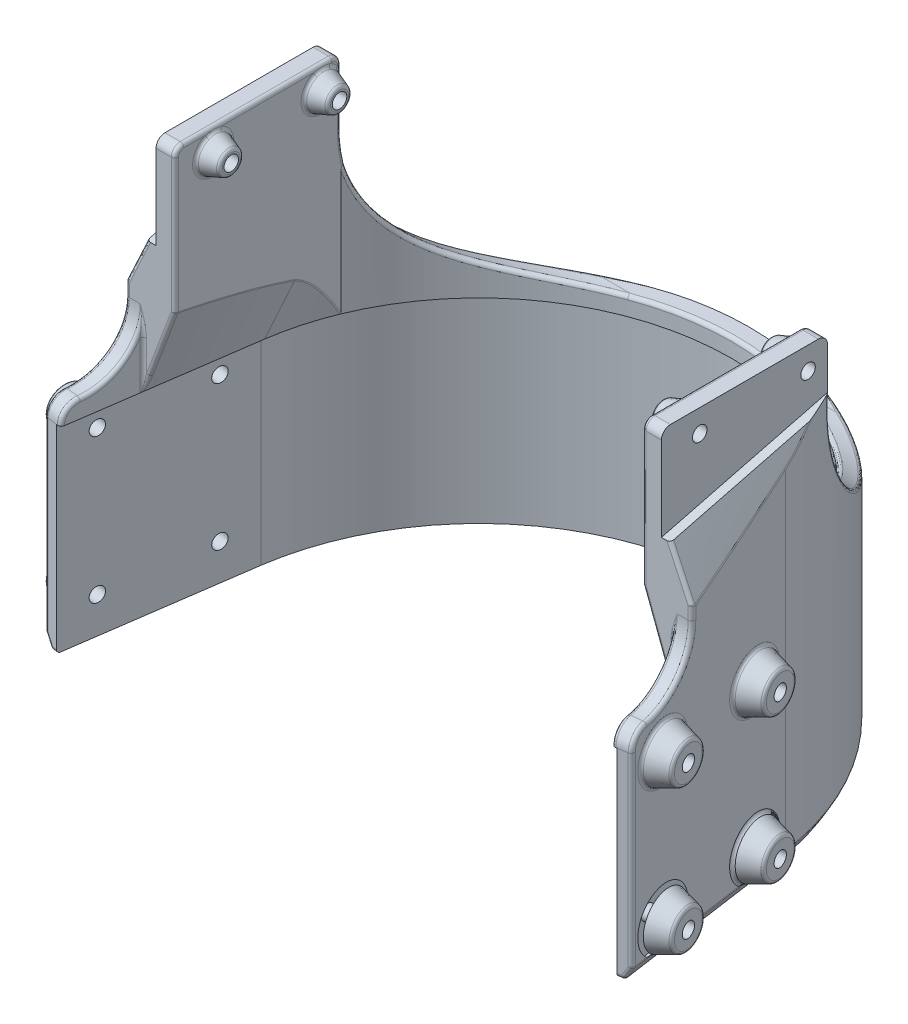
SolidWorks part; units mm, degrees
ref_plane "Front Plane" through (0, 0, 0) normal (0, 0, 1) x (1, 0, 0)
ref_plane "Top Plane" through (0, 0, 0) normal (0, 1, 0) x (1, 0, 0)
ref_plane "Right Plane" through (0, 0, 0) normal (1, 0, 0) x (0, 0, -1)
sketch "Sketch1" plane through (0, 0, 0) normal (0, 1, 0) x (1, 0, 0)
  line L0 (-94.2861, -143.8372) -> (-103.2971, -206.6946)
  line L1 (-103.2971, -206.6946) -> (-98.5828, -207.3704)
  line L2 (-98.5828, -207.3704) -> (-89.5718, -144.513)
  line L3 (0, -157.3537) -> (0, 60.4833) construction
  line L4 (103.2971, -206.6946) -> (98.5828, -207.3704)
  line L5 (98.5828, -207.3704) -> (89.5718, -144.513)
  line L6 (94.2861, -143.8372) -> (103.2971, -206.6946)
  line L8 (0, -157.3537) -> (-94.2861, -143.8372) construction
  line L9 (-89.5718, -144.513) -> (-107.0231, -266.2464) construction
  arc A0 (94.2861, -143.8372) -> (-94.2861, -143.8372) centre (0, -157.3537) ccw
  arc A1 (-89.5718, -144.513) -> (89.5718, -144.513) centre (0, -157.3537) cw
  arc A2 (89.5718, -144.513) -> (-89.5718, -144.513) centre (0, -157.3537) ccw construction
  dimension "D2" = 4.7625
  dimension "D3" = 63.5
extrude "Boss-Extrude1" add sketch "Sketch1" along normal blind 76.2
sketch "Sketch17" plane through (0, 76.2, 0) normal (0, 1, 0) x (1, 0, 0)
  line L10 (-97.0114, -207.5957) -> (-88.0003, -144.7383)
  line L11 (88.0003, -144.7383) -> (97.0114, -207.5957)
  line L12 (-98.5828, -207.3704) -> (-89.5718, -144.513)
  line L13 (89.5718, -144.513) -> (98.5828, -207.3704)
  line L14 (-98.5828, -207.3704) -> (-89.5718, -144.513)
  line L15 (89.5718, -144.513) -> (98.5828, -207.3704)
  line L16 (98.5828, -207.3704) -> (97.0114, -207.5957)
  line L17 (-97.0114, -207.5957) -> (-98.5828, -207.3704)
  arc A4 (88.0003, -144.7383) -> (-88.0003, -144.7383) centre (0, -157.3537) ccw
  arc A5 (89.5718, -144.513) -> (-89.5718, -144.513) centre (0, -157.3537) ccw
  arc A6 (89.5718, -144.513) -> (-89.5718, -144.513) centre (0, -157.3537) ccw
  dimension "D1" = 0
  dimension "D2" = 1.5875
extrude "Boss-Extrude5" add sketch "Sketch17" against normal blind 6.35
sketch "Sketch10" plane through (0, 69.85, 0) normal (0, 1, 0) x (1, 0, 0)
  line L0 (-99.7636, -182.0462) -> (-82.2536, -182.0462)
  line L1 (-94.2861, -143.8372) -> (-103.2971, -206.6946) construction
  line L2 (-88.9, -185.8562) -> (-85.725, -185.8562) construction
  line L3 (-99.7636, -182.0462) -> (-94.2861, -143.8372)
  line L5 (-88.9, -192.0474) -> (-88.9, -103.6441) construction
  line L20 (-82.2536, -182.0462) -> (-82.2536, -123.6262)
  line L21 (-82.2536, -123.6262) -> (-89.0787, -123.6262)
  arc A0 (-94.2861, -143.8372) -> (-89.0787, -123.6262) centre (0, -157.3537) cw
  arc A1 (94.2861, -143.8372) -> (-94.2861, -143.8372) centre (0, -157.3537) ccw construction
  arc A2 (88.0003, -144.7383) -> (-88.0003, -144.7383) centre (0, -157.3537) ccw construction
  dimension "D1" = 3.81
  dimension "D2" = 58.42
  dimension "D3" = 6.6464
extrude "Boss-Extrude3" add sketch "Sketch10" along normal up to surface (79.502 mm away)
sketch "Sketch22" plane through (0, 149.352, 0) normal (0, 1, 0) x (1, 0, 0)
  line L4 (-88.9, -123.1579) -> (-88.9, -182.0462)
  line L6 (-88.9, -192.0474) -> (-88.9, -103.6441) construction
  line L8 (-94.2861, -143.8372) -> (-99.7636, -182.0462)
  line L9 (-99.7636, -182.0462) -> (-82.2536, -182.0462)
  line L10 (-82.2536, -182.0462) -> (-82.2536, -123.6262)
  line L11 (-82.2536, -123.6262) -> (-89.0787, -123.6262)
  line L12 (-94.2861, -143.8372) -> (-99.7636, -182.0462)
  line L13 (-99.7636, -182.0462) -> (-88.9, -182.0462)
  arc A2 (-89.0787, -123.6262) -> (-94.2861, -143.8372) centre (0, -157.3537) ccw
  arc A3 (-88.9, -123.1579) -> (-94.2861, -143.8372) centre (0, -157.3537) ccw
  dimension "D1" = 0
extrude "Cut-Extrude4" cut sketch "Sketch22" against normal up to surface (32.818 mm away)
sketch "Sketch29" plane through (0, 0, 182.0462) normal (0, 0, 1) x (1, 0, 0)
  line L0 (-92.075, 116.534) -> (-99.7636, 100.024)
  line L1 (-99.7636, 116.534) -> (-99.7636, 76.2) construction
  line L2 (-99.7636, 100.024) -> (-99.7636, 116.534)
  line L3 (-99.7636, 116.534) -> (-92.075, 116.534)
  line L4 (-88.9, 116.534) -> (-99.7636, 116.534) construction
  dimension "D1" = 3.175
  dimension "D2" = 16.51
sketch "Sketch30" plane through (0, 0, 123.6262) normal (0, 0, -1) x (-1, 0, 0)
  line L0 (92.075, 131.4708) -> (98.425, 131.4708)
  line L1 (98.425, 131.4708) -> (98.425, 114.9608)
  line L2 (98.425, 114.9608) -> (92.075, 131.4708)
  line L3 (88.9, 131.4708) -> (88.9, 149.352) construction
  dimension "D1" = 3.175
  dimension "D2" = 16.51
  dimension "D3" = 6.35
loft "Cut-Loft3" cut profiles "Sketch29", "Sketch30"
sketch "Sketch26" plane through (0, 69.85, 0) normal (0, -1, 0) x (1, 0, 0)
  line L0 (-93.3487, 182.0462) -> (-82.2536, 182.0462)
  line L1 (-82.2536, 182.0462) -> (-82.2536, 123.6262)
  line L2 (-82.2536, 182.0462) -> (-82.2536, 123.6262) construction
  line L3 (-93.3487, 182.0462) -> (-88.0003, 144.7383)
  line L5 (-97.0114, 207.5957) -> (-93.3487, 182.0462) construction
  arc A0 (-88.0003, 144.7383) -> (-82.2536, 123.6262) centre (0, 157.3537) ccw
  arc A1 (-89.5718, 144.513) -> (89.5718, 144.513) centre (0, 157.3537) ccw construction
sketch "Sketch28" plane through (0, 149.352, 0) normal (0, 1, 0) x (1, 0, 0)
  line L0 (-63.2036, -123.6262) -> (-63.2036, -182.0462)
  line L1 (-63.2036, -182.0462) -> (-50.5036, -182.0462)
  line L2 (-50.5036, -182.0462) -> (-63.2036, -123.6262)
  line L3 (-93.3487, -182.0462) -> (-82.2536, -182.0462) construction
  line L4 (-82.2536, -123.6262) -> (-63.2036, -123.6262) construction
  line L5 (-82.2536, -182.0462) -> (-82.2536, -123.6262) construction
  dimension "D1" = 19.05
  dimension "D2" = 12.7
loft "Cut-Loft1" cut profiles "Sketch26", "Sketch28"
hole_wizard "1/4-20 Tapped Hole1" positions "Sketch12" profile "Sketch13" tap size "1/4-20" standard "ANSI Inch"
sketch "Sketch12" plane through (-88.9, 0, 0) normal (-1, 0, 0) x (0, 0, 1)
  circle A0 centre (130.4619, 141.4145) radius 3.5719 construction
  circle A1 centre (168.5619, 141.4145) radius 3.5719 construction
  point P0 (168.5619, 141.4145)
  point P2 (130.4619, 141.4145)
sketch "Sketch13" plane through (-88.9, 141.4145, 168.5619) normal (0, 1, 0) x (0, 0, 1)
  line L0 (0, 0) -> (0, 177.8)
  line L1 (0, 177.8) -> (2.5527, 177.8)
  line L2 (2.5527, 177.8) -> (2.5527, 0)
  line L5 (2.5527, 0) -> (0, 0)
  line L11 (0, -6.35) -> (0, 107.95) construction
  dimension "Thread Major Dia." = 5.1054
  dimension "Thru Tap Drill Depth" = 177.8
hole_wizard "1/4-20 Tapped Hole2" positions "Sketch14" profile "Sketch15" tap size "1/4-20" standard "ANSI Inch"
sketch "Sketch14" plane through (-72.1826, 0, -10.3479) normal (-0.9899, 0, -0.1419) x (-0.1419, 0, 0.9899)
  line L1 (168.4613, 63.5) -> (206.5613, 63.5) construction
  line L2 (168.4613, 63.5) -> (168.4613, 12.7) construction
  line L3 (168.4613, 12.7) -> (206.5613, 12.7) construction
  line L4 (206.5613, 63.5) -> (206.5613, 12.7) construction
  line L5 (168.4613, 63.5) -> (206.5613, 12.7) construction
  line L6 (168.4613, 12.7) -> (206.5613, 63.5) construction
  line L7 (219.2613, 38.1) -> (187.5113, 38.1) construction
  line L11 (187.5113, 0) -> (187.5113, 38.1) construction
  line L12 (155.7613, 0) -> (219.2613, 0) construction
  line L13 (219.2613, 76.2) -> (219.2613, 0) construction
  point P3 (206.5613, 12.7)
  point P110 (168.4613, 63.5)
  point P111 (168.4613, 12.7)
  point P112 (206.5613, 63.5)
  dimension "D1" = 50.8
  dimension "D2" = 38.1
sketch "Sketch15" plane through (-101.4949, 12.7, 194.1231) normal (0, 1, 0) x (-0.1419, 0, 0.9899)
  line L0 (0, 0) -> (0, 13.6835)
  line L1 (0, 13.6835) -> (2.5527, 13.6835)
  line L2 (2.5527, 13.6835) -> (2.5527, 0)
  line L5 (2.5527, 0) -> (0, 0)
  line L11 (0, -6.35) -> (0, 107.95) construction
  dimension "Thread Major Dia." = 5.1054
  dimension "Thru Tap Drill Depth" = 13.6835
fillet "Fillet20" radius 50.8 1 edges at (-85.6662, 76.2, 123.6262)
fillet "Fillet21" radius 19.812 1 edges at (-96.5561, 76.2, 182.0462)
chamfer "Chamfer6" distance 2.54 angle 60 3 edges at (-98.7916, 0, 175.2659) (0, 0, 62.1037) (98.7916, 0, 175.2659)
sketch "Sketch31" plane through (-72.1826, 0, -10.3479) normal (-0.9899, 0, -0.1419) x (-0.1419, 0, 0.9899)
  circle A0 centre (168.4613, 63.5) radius 9.525
  circle A1 centre (206.5613, 63.5) radius 9.525
  circle A2 centre (206.5613, 12.7) radius 9.525
  circle A3 centre (168.4613, 12.7) radius 9.525
  dimension "D1" = 19.05
extrude "Boss-Extrude6" add sketch "Sketch31" along normal blind 7.9375
hole_wizard "1/4-20 Tapped Hole3" positions "Sketch32" profile "Sketch33" tap size "1/4-20" standard "ANSI Inch"
sketch "Sketch32" plane through (-80.0398, 0, -11.4743) normal (-0.9899, 0, -0.1419) x (-0.1419, 0, 0.9899)
  point P0 (168.4613, 63.5)
  point P3 (206.5613, 63.5)
  point P6 (206.5613, 12.7)
  point P9 (168.4613, 12.7)
sketch "Sketch33" plane through (-103.9455, 63.5, 155.2823) normal (0, 1, 0) x (-0.1419, 0, 0.9899)
  line L0 (0, 0) -> (0, 206.1523)
  line L1 (0, 206.1523) -> (2.5527, 206.1523)
  line L2 (2.5527, 206.1523) -> (2.5527, 0)
  line L5 (2.5527, 0) -> (0, 0)
  line L11 (0, -6.35) -> (0, 107.95) construction
  dimension "Thread Major Dia." = 5.1054
  dimension "Thru Tap Drill Depth" = 206.1523
sketch "Sketch34" plane through (-82.2536, 0, 0) normal (1, 0, 0) x (0, 0, -1)
  circle A0 centre (-130.4619, 141.4145) radius 6.35
  circle A1 centre (-168.5619, 141.4145) radius 6.35
  circle A2 centre (-168.5619, 141.4145) radius 2.5527 construction
  circle A3 centre (-130.4619, 141.4145) radius 2.5527 construction
  dimension "D1" = 12.7
extrude "Boss-Extrude7" add sketch "Sketch34" along normal blind 6.35
hole_wizard "1/4-20 Tapped Hole4" positions "Sketch35" profile "Sketch36" tap size "1/4-20" standard "ANSI Inch"
sketch "Sketch35" plane through (-75.9036, 0, 0) normal (1, 0, 0) x (0, 0, -1)
  circle A0 centre (-130.4619, 141.4145) radius 6.35 construction
  point P0 (-130.4619, 141.4145)
  point P3 (-168.5619, 141.4145)
sketch "Sketch36" plane through (-75.9036, 141.4145, 130.4619) normal (0, 1, 0) x (0, 0, -1)
  line L0 (0, 0) -> (0, 6.351)
  line L1 (0, 6.351) -> (2.5527, 6.351)
  line L2 (2.5527, 6.351) -> (2.5527, 0)
  line L5 (2.5527, 0) -> (0, 0)
  line L11 (0, -6.35) -> (0, 107.95) construction
  dimension "Thread Major Dia." = 5.1054
  dimension "Thru Tap Drill Depth" = 6.351
mirror "Mirror2" about plane through (0, 0, 0) normal (1, 0, 0) of "1/4-20 Tapped Hole4", "Boss-Extrude7", "1/4-20 Tapped Hole2", "1/4-20 Tapped Hole1", "Cut-Loft1", "Cut-Loft3", "Cut-Extrude4", "Boss-Extrude3", "Fillet20", "Fillet21", "Boss-Extrude6", "1/4-20 Tapped Hole3"
chamfer "Chamfer4" distance 7.9375 angle 20 4 edges at (-110.7037, 12.7, 202.4253) (-105.2971, 12.7, 164.7109) (-110.7037, 63.5, 202.4253) (-105.2971, 63.5, 164.7109)
chamfer "Chamfer5" distance 7.9375 angle 20 4 edges at (110.7037, 12.7, 202.4253) (110.7037, 63.5, 202.4253) (105.2971, 63.5, 164.7109) (105.2971, 12.7, 164.7109)
fillet "Fillet40" radius 3.175 4 edges at (85.5768, 149.352, 123.6262) (-85.5768, 149.352, 123.6262) (-85.5768, 149.352, 182.0462) (85.5768, 149.352, 182.0462)
fillet "Fillet36" radius 6.35 2 edges at (-100.1543, 76.2, 207.1451) (100.1543, 76.2, 207.1451)
fillet "Fillet33" radius 1.27 20 edges at (-110.2938, 12.7, 199.5655) (-104.8871, 12.7, 161.8511) (-110.2938, 63.5, 199.5655) (-104.8871, 63.5, 161.8511) (-100.1433, 63.5, 184.6945) (-101.4949, 22.225, 194.1231) (-96.0883, 22.225, 156.4087) (-94.7366, 63.5, 146.98) (97.4399, 63.5, 165.8373) (103.0038, 63.5, 148.7134) (102.8466, 63.5, 203.5517) (108.4104, 63.5, 186.4279) (101.4949, 22.225, 194.1231) (108.4104, 12.7, 186.4279) (96.0883, 22.225, 156.4087) (103.0038, 12.7, 148.7134) (101.4949, 3.175, 194.1231) (96.0883, 3.175, 156.4087) (-101.4949, 3.175, 194.1231) (-96.0883, 3.175, 156.4087)
fillet "Fillet34" radius 1.27 26 edges at (-102.8423, 4.3994, 203.5217) (-102.3622, 4.4187, 200.0943) (-100.7236, 4.4904, 188.3726) (-101.1179, 4.8767, 188.7371) (-102.5998, 4.8397, 199.4461) (-98.7916, 4.3994, 175.2659) (-96.9556, 4.4187, 162.3798) (-95.317, 4.4904, 150.6581) (102.8423, 4.3994, 203.5217) (100.6497, 4.4187, 188.1488) (102.3702, 4.4904, 199.8587) (101.0598, 4.8397, 188.7041) (102.6463, 4.8767, 199.398) (98.7916, 4.3994, 175.2659) (95.2431, 4.4187, 150.4343) (96.9636, 4.4904, 162.1443) (-95.7113, 4.8767, 151.0227) (-97.1932, 4.8397, 161.7317) (-94.7409, 4.3994, 147.01) (0, 4.3994, 62.1037) (94.7409, 4.3994, 147.01) (95.6532, 4.8397, 150.9896) (97.2396, 4.8767, 161.6836) (96.2773, 0, 175.6263) (0, 0, 64.6437) (-96.2773, 0, 175.6263)
fillet "Fillet30" radius 1.27 13 edges at (-82.2536, 122.6441, 182.0462) (-82.2536, 149.352, 152.8362) (-82.2536, 136.5885, 123.6262) (-73.9945, 90.4227, 108.0787) (82.2536, 122.6441, 182.0462) (82.2536, 149.352, 152.8362) (82.2536, 136.5885, 123.6262) (71.6632, 87.4807, 104.7458) (0, 76.2, 68.4537) (-82.2536, 148.4221, 181.1162) (-82.2536, 148.4221, 124.5561) (82.2536, 148.4221, 181.1162) (82.2536, 148.4221, 124.5561)
fillet "Fillet32" radius 1.27 1 edges at (84.1722, 95.6148, 112.7712)
fillet "Fillet35" radius 1.27 42 edges at (-97.4723, 108.4511, 166.063) (-94.1595, 82.1511, 187.7022) (97.0114, 69.8529, 207.5957) (-97.0114, 69.8529, 207.5957) (90.8027, 130.2021, 128.5886) (96.5385, 112.0124, 159.5495) (100.5403, 82.3983, 187.4643) (-100.5403, 82.3983, 187.4643) (-99.2884, 76.2146, 201.098) (-96.6877, 74.7305, 205.338) (-103.2971, 37.3149, 206.6946) (-100.1553, 69.8691, 207.145) (-103.1225, 73.6475, 205.4762) (94.1595, 82.1511, 187.7022) (99.2884, 76.2146, 201.098) (103.2971, 37.3149, 206.6946) (102.9968, 74.6228, 204.5999) (100.1553, 69.8691, 207.145) (96.8139, 73.8226, 206.2183) (-99.3199, 0, 207.2647) (102.1372, 2.3699, 206.8608) (103.2543, 4.411, 206.7007) (100.6856, 0.1701, 207.0689) (-102.1372, 2.3699, 206.8608) (-100.6856, 0.1701, 207.0689) (-103.2543, 4.411, 206.7007) (99.3199, 0, 207.2647) (-90.8027, 130.2021, 128.5886)
fillet "Fillet37" radius 1.27 10 edges at (-82.2536, 82.875, 132.9523) (-82.2536, 96.0602, 167.7617) (-93.354, 70.0793, 182.6923) (82.2536, 82.875, 132.9523) (93.407, 69.9796, 182.7973) (82.2536, 96.0602, 167.7617)
chamfer "Chamfer8" distance 6.35 angle 20 2 edges at (-75.9036, 141.4145, 162.2119) (-75.9036, 141.4145, 124.1119)
chamfer "Chamfer9" distance 6.35 angle 20 2 edges at (75.9036, 141.4145, 124.1119) (75.9036, 141.4145, 162.2119)
fillet "Fillet39" radius 1.27 10 edges at (82.2536, 141.4145, 136.8119) (82.2536, 141.4145, 124.1119) (75.9036, 141.4145, 134.5006) (82.2536, 141.4145, 174.9119) (75.9036, 141.4145, 172.6006) (-75.9036, 141.4145, 126.4231) (-82.2536, 141.4145, 136.8119) (-82.2536, 141.4145, 124.1119) (-75.9036, 141.4145, 164.5231) (-82.2536, 141.4145, 174.9119)
